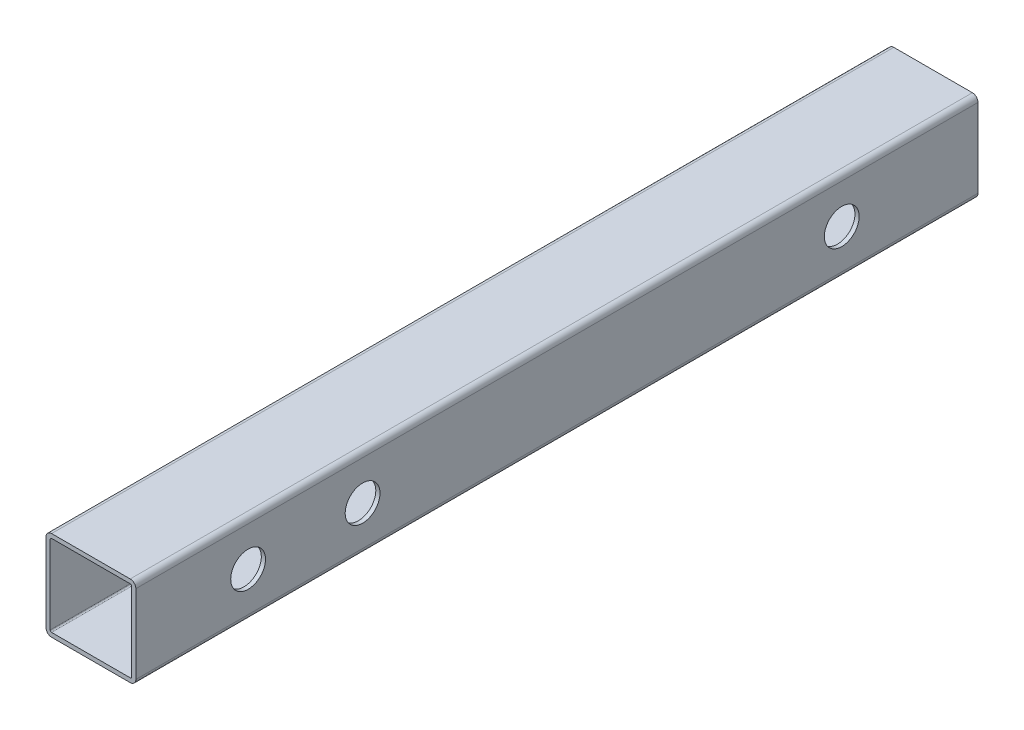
SolidWorks part; units mm, degrees
ref_plane "Front" through (0, 0, 0) normal (0, 0, 1) x (1, 0, 0)
ref_plane "Top" through (0, 0, 0) normal (0, 1, 0) x (1, 0, 0)
ref_plane "Right" through (0, 0, 0) normal (1, 0, 0) x (0, 0, -1)
sketch "Sketch1" plane through (0, 0, 0) normal (0, 0, 1) x (1, 0, 0)
  line L0 (-44.45, 46.0375) -> (44.45, 46.0375)
  line L1 (-44.45, 50.8) -> (44.45, 50.8)
  line L2 (-50.8, 44.45) -> (-50.8, -44.45)
  line L3 (-44.45, -50.8) -> (44.45, -50.8)
  line L4 (50.8, 44.45) -> (50.8, -44.45)
  line L5 (46.0375, 44.45) -> (46.0375, -44.45)
  line L6 (-44.45, -46.0375) -> (44.45, -46.0375)
  line L7 (-46.0375, 44.45) -> (-46.0375, -44.45)
  arc A0 (-50.8, 44.45) -> (-44.45, 50.8) centre (-44.45, 44.45) cw
  arc A1 (50.8, 44.45) -> (44.45, 50.8) centre (44.45, 44.45) ccw
  arc A2 (44.45, -50.8) -> (50.8, -44.45) centre (44.45, -44.45) ccw
  arc A3 (-44.45, -50.8) -> (-50.8, -44.45) centre (-44.45, -44.45) cw
  arc A4 (46.0375, 44.45) -> (44.45, 46.0375) centre (44.45, 44.45) ccw
  arc A5 (44.45, -46.0375) -> (46.0375, -44.45) centre (44.45, -44.45) ccw
  arc A6 (-44.45, -46.0375) -> (-46.0375, -44.45) centre (-44.45, -44.45) cw
  arc A7 (-46.0375, 44.45) -> (-44.45, 46.0375) centre (-44.45, 44.45) cw
  point P7 (-50.8, 50.8)
  point P12 (50.8, -50.8)
  point P15 (-50.8, -50.8)
  dimension "D5" = 6.35
  dimension "D1" = 50.8
  dimension "D2" = 50.8
  dimension "D3" = 101.6
  dimension "D4" = 101.6
  dimension "D6" = 4.7625
extrude "Extrude1" add sketch "Sketch1" along normal mid plane 952.5
sketch "Sketch2" plane through (-50.8, 0, 0) normal (-1, 0, 0) x (0, 0, 1)
  line L0 (-476.25, 0) -> (476.25, 0) construction
  line L1 (-476.25, 44.45) -> (-476.25, -44.45) construction
  line L2 (476.25, 44.45) -> (476.25, -44.45) construction
  line L3 (-322.138, 0) -> (-322.138, -44.45) construction
  line L4 (476.25, -44.45) -> (-476.25, -44.45) construction
  line L5 (219.776, 0) -> (219.776, -44.45) construction
  circle A0 centre (-322.138, 0) radius 19.685
  circle A1 centre (219.776, 0) radius 19.685
  circle A2 centre (349.25, 0) radius 19.685
  dimension "D2" = 39.37
  dimension "D1" = 154.112
  dimension "D3" = 256.474
  dimension "D4" = 127
extrude "Cut-Extrude1" cut sketch "Sketch2" against normal through all
